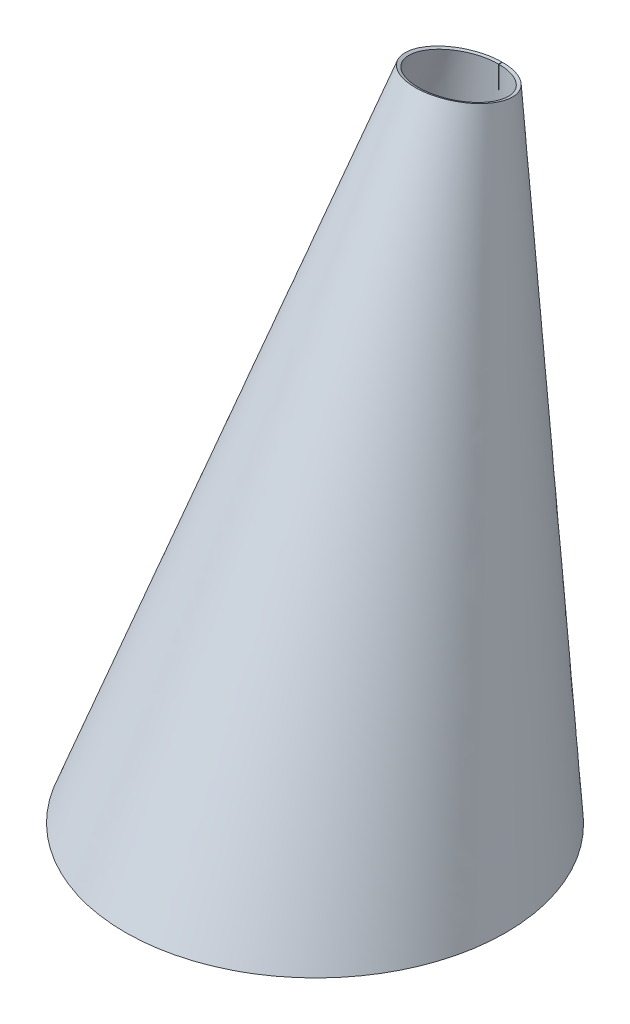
SolidWorks part; units mm, degrees
ref_plane "Ebene vorne" through (0, 0, 0) normal (0, 0, 1) x (1, 0, 0)
ref_plane "Ebene oben" through (0, 0, 0) normal (0, 1, 0) x (1, 0, 0)
ref_plane "Ebene rechts" through (0, 0, 0) normal (1, 0, 0) x (0, 0, -1)
sketch "Skizze1" plane through (0, 0, 0) normal (0, 1, 0) x (1, 0, 0)
  arc A0 (-0.05, 54) -> (0.05, 54) centre (0, 0) ccw
  arc A1 (0.05, 54) -> (-0.05, 54) centre (0, 0) ccw construction
  point P1 (0, 54)
  point P3 (-8.9081, 106.6148)
  point P4 (10.2292, 106.4962)
  point P6 (4.1118, 106.9073)
  dimension "D2" = 54
  dimension "D1" = 0.1
sketch "Skizze2" plane through (0, 0, 0) normal (1, 0, 0) x (0, 0, -1)
  line L0 (0, 0) -> (41.6106, 166.8909) construction
  line L1 (0, 0) -> (0, 207.2655) construction
  dimension "D1" = 14
  dimension "D2" = 172
ref_plane "Ebene1" through (0, 166.8909, -41.6106) normal (0, 0.9703, -0.2419) x (-1, 0, 0)
sketch "Skizze3" plane through (0, 166.8909, -41.6106) normal (0, 0.9703, -0.2419) x (-1, 0, 0)
  arc A0 (-0.05, -11.9999) -> (0.05, -11.9999) centre (0, 0) ccw construction
  arc A1 (0.05, -11.9999) -> (-0.05, -11.9999) centre (0, 0) ccw
  point P1 (0, -12)
  point P3 (-6.8495, -67.238)
  point P4 (9.7456, -66.8797)
  point P6 (0, -76.4962)
  dimension "D2" = 12
  dimension "D1" = 0.1
sheet metal parameters "Blech1" thickness 1 parameters "D1"=20, "Dicke"=1
lofted bend "Ausgeformte Biegungen1" parameters "D1"=0, "D12"=1
other "Freiform-Biegung1" parameters "D1"=1000, "D4"=57.296, "D5"=1
flat pattern "Abwicklung1"
sketch "Biegung-Linien1" plane through (0, 0, 0) normal (0, 1, 0) x (-1, 0, 0)
other "Abwickeln-<Freiform-Biegung1>1"
